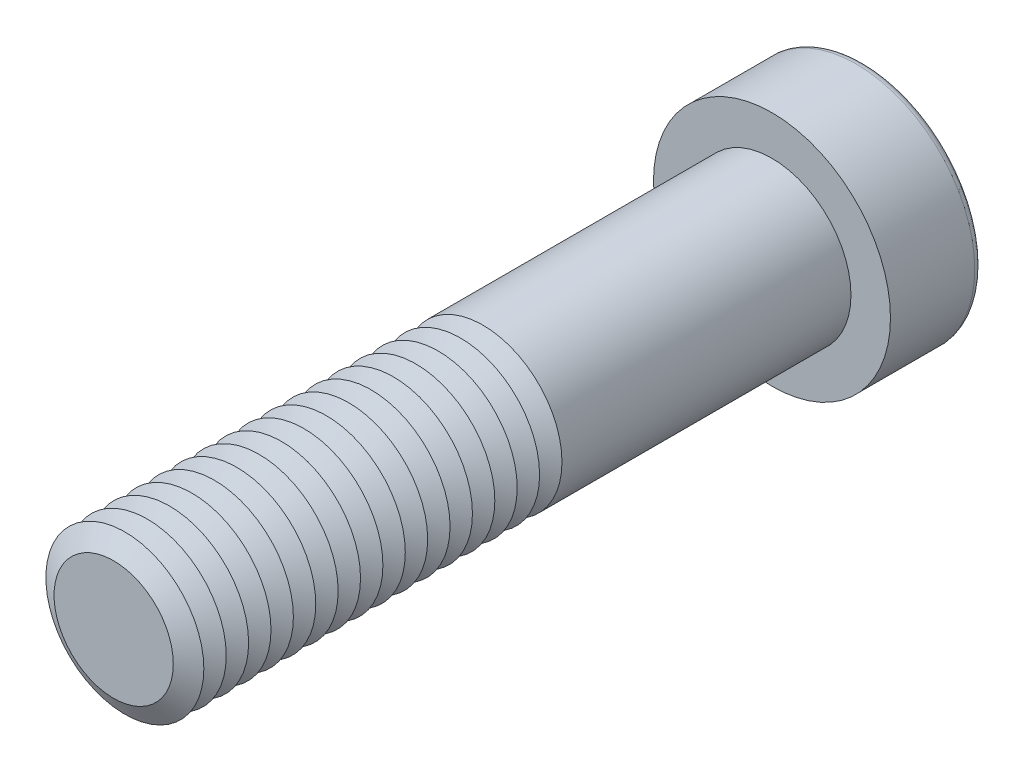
SolidWorks part; units mm, degrees
ref_plane "Front Plane" through (0, 0, 0) normal (0, 0, 1) x (1, 0, 0)
ref_plane "Top Plane" through (0, 0, 0) normal (0, 1, 0) x (1, 0, 0)
ref_plane "Right Plane" through (0, 0, 0) normal (1, 0, 0) x (0, 0, -1)
sketch "Sketch1" plane through (0, 0, 0) normal (0, 0, 1) x (1, 0, 0)
  circle A0 centre (0, 0) radius 6
  dimension "D1" = 12
extrude "Boss-Extrude1" add sketch "Sketch1" along normal blind 50
sketch "Sketch2" plane through (0, 0, 0) normal (0, 0, -1) x (-1, 0, 0)
  circle A0 centre (0, 0) radius 9
  dimension "D1" = 18
extrude "Boss-Extrude2" add sketch "Sketch2" along normal blind 7
sketch "Sketch3" plane through (0, 0, -7) normal (0, 0, -1) x (-1, 0, 0)
  line L1 (-2.3094, 4) -> (-4.6188, 0)
  line L2 (-4.6188, 0) -> (-2.3094, -4)
  line L3 (-2.3094, -4) -> (2.3094, -4)
  line L4 (2.3094, -4) -> (4.6188, 0)
  line L5 (4.6188, 0) -> (2.3094, 4)
  line L6 (2.3094, 4) -> (-2.3094, 4)
  circle A0 centre (0, 0) radius 4 construction
  dimension "D1" = 8
extrude "Cut-Extrude1" cut sketch "Sketch3" against normal blind 6
fillet "Fillet1" radius 0.6 1 edges at (-9, 0, -7)
sketch "Sketch4" plane through (0, 0, -1) normal (0, 0, -1) x (-1, 0, 0)
  line L0 (2.3094, -4) -> (4.6188, 0) construction
  circle A0 centre (0, 0) radius 4
extrude "Cut-Extrude2" cut sketch "Sketch4" against normal through all draft 60
sketch "Sketch5" plane through (0, 0, -7) normal (0, 0, -1) x (-1, 0, 0)
  circle A0 centre (0, 0) radius 4.6188
extrude "Cut-Extrude3" cut sketch "Sketch5" against normal through all draft 75
sketch "Sketch7" plane through (0, 0, 0) normal (1, 0, 0) x (0, 0, -1)
  line L25 (-50, 4.5278) -> (-49.15, 6)
  line L26 (-50, 6) -> (-50, -6) construction
  line L27 (-49.15, 6) -> (-50.85, 6)
  line L28 (-50.85, 6) -> (-50, 4.5278)
  line L29 (0, 6) -> (-50, 6) construction
  dimension "D1" = 1.7
revolve "Cut-Revolve1" cut sketch "Sketch7" angle 360 about axis through (0, 0, 50) along (0, 0, -1)
pattern_linear "LPattern1" count 17 spacing 1.7 along (0, 0, -1) of "Cut-Revolve1"
